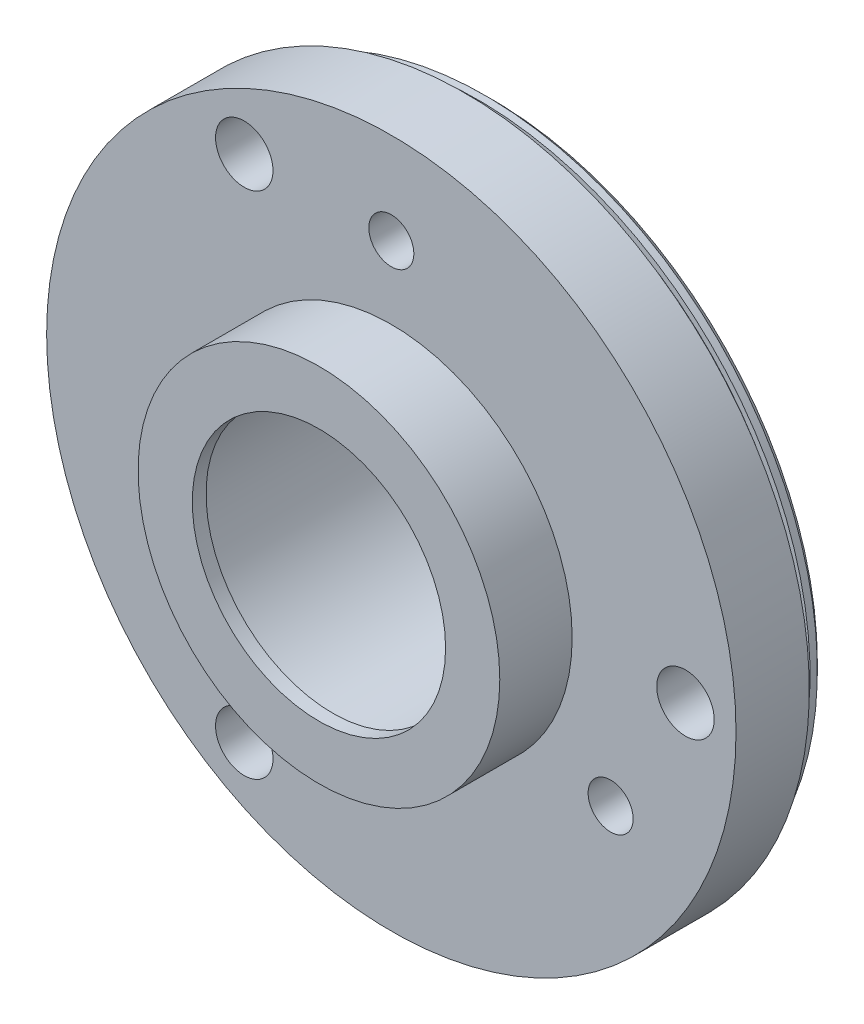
SolidWorks part; units mm, degrees
ref_plane "Plane1" through (0, 0, 0) normal (0, 0, 1) x (1, 0, 0)
ref_plane "Plane2" through (0, 0, 0) normal (0, 1, 0) x (1, 0, 0)
ref_plane "Plane3" through (0, 0, 0) normal (1, 0, 0) x (0, 0, -1)
sketch "Sketch2" plane through (0, 0, 0) normal (0, 0, 1) x (1, 0, 0)
  circle A0 centre (0, 0) radius 19.05
  dimension "D1" = 38.1
extrude "Base-Extrude" add sketch "Sketch2" along normal blind 10.5918
sketch "Sketch5" plane through (0, 0, 10.5918) normal (0, 0, 1) x (1, 0, 0)
  circle A0 centre (0, 0) radius 9.9949
  circle A1 centre (0, 0) radius 22.86
  dimension "D1" = 19.9898
  dimension "D2" = 45.72
extrude "Cut-Extrude3" cut sketch "Sketch5" against normal blind 4.0005
sketch "Sketch7" plane through (0, 0, 0) normal (0, 0, -1) x (-1, 0, 0)
  circle A0 centre (0, 0) radius 12.3444
  circle A1 centre (0, 0) radius 20.32
  dimension "D1" = 24.6888
  dimension "D2" = 40.64
extrude "Cut-Extrude4" cut sketch "Sketch7" against normal blind 1.016
sketch "Sketch10" plane through (0, 0, 6.5913) normal (0, 0, 1) x (1, 0, 0)
  line L0 (0, 0) -> (-11.3592, -19.6748) construction
  line L1 (0, 0) -> (27.0006, 0) construction
  line L2 (0, 0) -> (-10.925, 18.9226) construction
  line L3 (0, 0) -> (25.4, 0) construction
  line L4 (0, 0) -> (0, 20.32) construction
  circle A0 centre (0, 0) radius 16.256 construction
  circle A1 centre (-8.128, 14.0781) radius 1.0922
  circle A2 centre (-8.128, -14.0781) radius 1.0922
  circle A3 centre (16.256, 0) radius 1.0922
  dimension "D4" = 2.1844
  dimension "D5" = 32.512
  dimension "D1" = 120
  dimension "D2" = 120
  dimension "D3" = 30
extrude "Cut-Extrude7" cut sketch "Sketch10" against normal through all
sketch "Sketch11" plane through (0, 0, 6.5913) normal (0, 0, 1) x (1, 0, 0)
  circle A0 centre (-8.128, 14.0781) radius 1.5875
  circle A1 centre (16.256, 0) radius 1.5875
  circle A2 centre (-8.128, -14.0781) radius 1.5875
  dimension "D1" = 3.175
extrude "Cut-Extrude8" cut sketch "Sketch11" against normal offset from surface (3.0353 mm away) 2.54
sketch "Sketch12" plane through (0, 0, 1.016) normal (0, 0, -1) x (-1, 0, 0)
  line L0 (0, 0) -> (0, 20.32) construction
  line L1 (0, 0) -> (13.1496, 17.4501) construction
  circle A0 centre (0, 0) radius 17.4625 construction
  circle A1 centre (10.5092, 13.9462) radius 0.3937
  dimension "D2" = 34.925
  dimension "D3" = 0.7874
  dimension "D1" = 37
extrude "Cut-Extrude9" cut sketch "Sketch12" against normal blind 1.778
sketch "Sketch14" plane through (0, 0, 1.016) normal (0, 0, -1) x (-1, 0, 0)
  circle A0 centre (0, 0) radius 18.3515
  circle A1 centre (0, 0) radius 20.32
  dimension "D1" = 36.703
  dimension "D2" = 40.64
extrude "Cut-Extrude11" cut sketch "Sketch14" against normal blind 1.524
sketch "Sketch15" plane through (0, 0, 0) normal (1, 0, 0) x (0, 0, -1)
  line L0 (-2.54, -19.05) -> (-2.54, 19.05) construction
  line L1 (-1.8034, 19.304) -> (-2.54, 19.304)
  line L2 (-1.8034, 18.034) -> (-2.54, 18.034)
  line L3 (-1.8034, 19.304) -> (-1.8034, 18.034)
  line L4 (-2.54, 18.034) -> (-2.54, 19.304)
  line L6 (0, 0) -> (-21.6625, 0) construction
  line L7 (-6.5913, 0) -> (-2.54, 0) construction
  dimension "D1" = 18.034
  dimension "D2" = 0.7366
  dimension "D3" = 1.27
revolve "Cut-Revolve1" cut sketch "Sketch15" angle 360 about L6
sketch "Sketch16" plane through (0, 0, 6.5913) normal (0, 0, 1) x (1, 0, 0)
  line L0 (0, 0) -> (0, 13.9954) construction
  line L1 (0, 0) -> (12.1204, -6.9977) construction
  line L2 (0, 0) -> (-12.1204, -6.9977) construction
  circle A0 centre (0, 0) radius 13.9954 construction
  circle A1 centre (0, 13.9954) radius 1.2446
  circle A2 centre (12.1204, -6.9977) radius 1.2446
  circle A3 centre (-12.1204, -6.9977) radius 1.2446
  dimension "D1" = 27.9908
  dimension "D2" = 2.4892
  dimension "D3" = 120
  dimension "D4" = 120
extrude "Cut-Extrude12" cut sketch "Sketch16" against normal blind 4.572
chamfer "Chamfer2" distance 0.381 angle 45 1 edges at (-18.3515, 0, 1.016)
sketch "Sketch18" plane through (0, 0, 0) normal (0, 0, -1) x (-1, 0, 0)
  circle A0 centre (0, 0) radius 8.255
  dimension "D1" = 16.51
extrude "Boss-Extrude1" add sketch "Sketch18" along normal blind 0.635
sketch "Sketch19" plane through (0, 0, -0.635) normal (0, 0, -1) x (-1, 0, 0)
  circle A0 centre (0, 0) radius 7.9451
  dimension "D1" = 15.8902
extrude "Cut-Extrude13" cut sketch "Sketch19" against normal offset from surface (10.4648 mm away) 0.762
sketch "Sketch20" plane through (0, 0, 10.5918) normal (0, 0, 1) x (1, 0, 0)
  circle A0 centre (0, 0) radius 7
  dimension "D1" = 14
extrude "Cut-Extrude14" cut sketch "Sketch20" against normal through all
chamfer "Chamfer4" distance 0.381 angle 25 1 edges at (-8.255, 0, -0.635)
